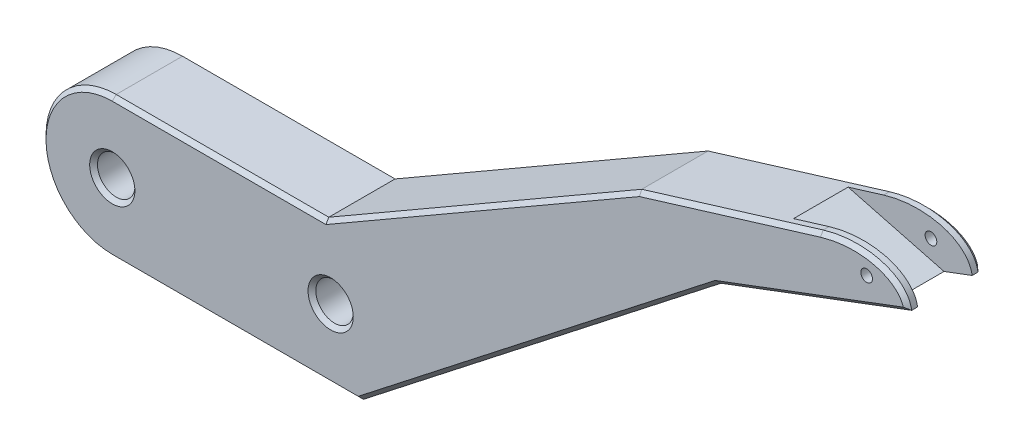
SolidWorks part; units mm, degrees
ref_plane "Front Plane" through (0, 0, 0) normal (0, 0, 1) x (1, 0, 0)
ref_plane "Top Plane" through (0, 0, 0) normal (0, 1, 0) x (1, 0, 0)
ref_plane "Right Plane" through (0, 0, 0) normal (1, 0, 0) x (0, 0, -1)
sketch "Sketch1" plane through (0, 0, 0) normal (0, 0, 1) x (1, 0, 0)
  line L14 (10, 28) -> (46.2616, 28)
  line L15 (10, 28) -> (10, 10)
  line L16 (10, 10) -> (50.7138, 10)
  line L23 (46.2616, 28) -> (86.3978, 51.1726)
  line L24 (50.7138, 10) -> (96.5513, 45.8122)
  line L25 (86.3978, 51.1726) -> (121.4078, 61.8763)
  line L28 (121.0092, 55.0295) -> (96.5513, 45.8122)
  line L29 (121.4078, 61.8763) -> (121.0092, 55.0295)
  circle A1 centre (19, 19) radius 2.4
  circle A3 centre (47, 19) radius 2.4
  circle A4 centre (115.7278, 56.5) radius 0.75
  point P8 (10, 19)
  point P9 (112, 59)
  point P13 (0, 0)
  point P17 (0, 0)
  point P18 (0, 0)
  point P19 (0, 0)
  point P21 (0, 0)
  point P22 (119.774, 61.3767)
  point P23 (0, 0)
  point P24 (117.8889, 60.8004)
  point P25 (118.1303, 60.8742)
  point P26 (120.6317, 54.4544)
  point P27 (118.6548, 53.8001)
  point P28 (120.1728, 54.6337)
  point P29 (121.0292, 55.0999)
  point P30 (120.2348, 61.5176)
  point P31 (119.8312, 54.5856)
  point P32 (0, 0)
  dimension "D1" = 4.8
  dimension "D3" = 1.5
  dimension "D8" = 4.8
  dimension "D13" = 38
  dimension "D5" = 11.4816
  dimension "D2" = 9
  dimension "D4" = 18
  dimension "D6" = 68.7278
  dimension "D7" = 150
  dimension "D9" = 28
  dimension "D10" = 10
  dimension "D11" = 10
  dimension "D12" = 37.5
  dimension "D15" = 193
  dimension "D16" = 58.1686
  dimension "D17" = 46.3452
  dimension "D19" = 9.7361
extrude "Boss-Extrude1" add sketch "Sketch1" along normal mid plane 9.5
fillet "Fillet1" radius 9 2 edges at (10, 10, 0) (10, 28, 0)
chamfer "Chamfer1" [suppressed] distance 1 angle 45
fillet "Fillet2" radius 5 1 edges at (121.4078, 61.8763, 0)
sketch "Sketch5" plane through (0, 0, 0) normal (0, 0, 1) x (1, 0, 0)
  line L0 (105.1055, 56.8921) -> (121.1496, 52.6907)
  line L1 (109.6643, 58.2859) -> (86.3978, 51.1726) construction
  line L3 (118.7628, 63.16) -> (105.1055, 56.8921)
  line L4 (118.7628, 63.16) -> (129.4726, 58.3019)
  line L5 (129.4726, 58.3019) -> (121.1496, 52.6907)
extrude "Cut-Extrude2" cut sketch "Sketch5" against normal mid plane 7
chamfer "Chamfer2" distance 0.5 angle 45 22 edges at (73.6325, 27.9061, -4.75) (34.8569, 10, -4.75) (12.636, 12.636, -4.75) (12.636, 25.364, -4.75) (66.3297, 39.5863, -4.75) (32.6308, 28, -4.75) (49.4, 19, 4.75) (21.4, 19, 4.75) (73.6325, 27.9061, 4.75) (34.8569, 10, 4.75) (12.636, 12.636, 4.75) (12.636, 25.364, 4.75) (66.3297, 39.5863, 4.75) (32.6308, 28, 4.75) (49.4, 19, -4.75) (21.4, 19, -4.75)
